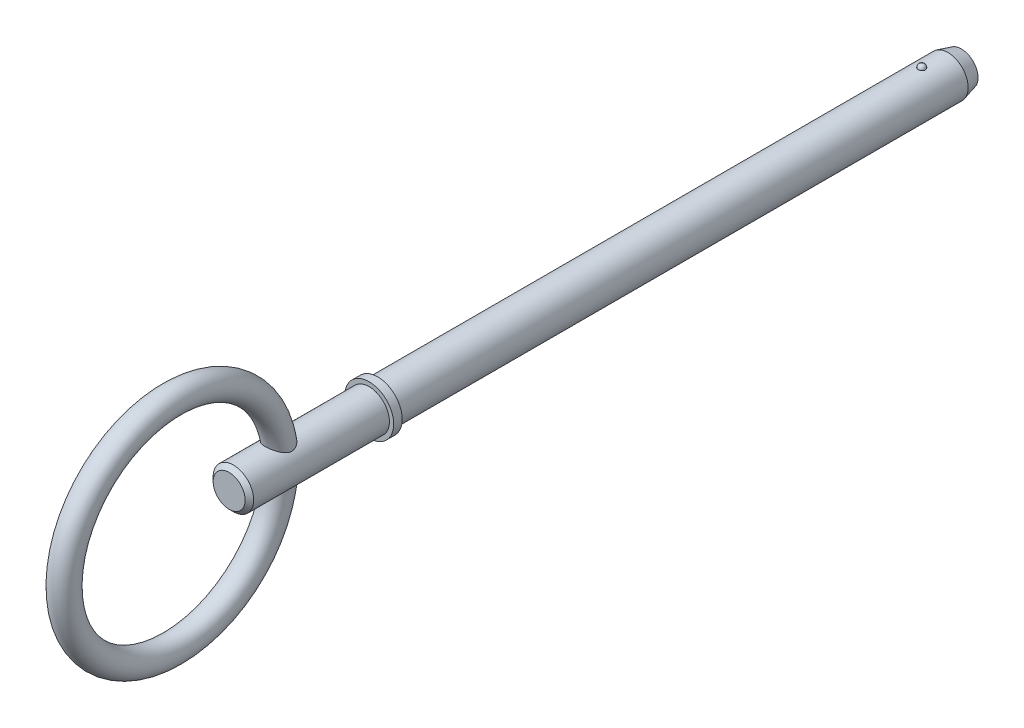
SolidWorks part; units mm, degrees
ref_plane "Front Plane" through (0, 0, 0) normal (0, 0, 1) x (1, 0, 0)
ref_plane "Top Plane" through (0, 0, 0) normal (0, 1, 0) x (1, 0, 0)
ref_plane "Right Plane" through (0, 0, 0) normal (1, 0, 0) x (0, 0, -1)
sketch "Sketch2" plane through (0, 0, 0) normal (0, 0, 1) x (1, 0, 0)
  circle A0 centre (0, 0) radius 2.38
  point P3 (0, 2.38)
  dimension "D1" = 4.76
extrude "Boss-Extrude1" add sketch "Sketch2" along normal blind 63.5
sketch "Sketch3" plane through (0, 0, 0) normal (0, 0, -1) x (-1, 0, 0)
  circle A0 centre (0, 0) radius 2.38
  dimension "D1" = 4.76
extrude "Boss-Extrude2" add sketch "Sketch3" along normal blind 5.08
chamfer "Chamfer1" distance 1.586 angle 15 1 edges at (-2.38, 0, -5.08)
sketch "Sketch18" plane through (0, 0, 0) normal (1, 0, 0) x (0, 0, -1)
  line L0 (3.494, 2.38) -> (-63.5, 2.38) construction
  line L1 (0.42, 2.8) -> (0.42, 1.96)
  line L2 (-63.5, -2.38) -> (3.494, -2.38) construction
  arc A0 (0.42, 2.8) -> (0.42, 1.96) centre (0.42, 2.38) ccw
  point P4 (0, 2.38)
  dimension "D1" = 5.18
revolve "Revolve1" add sketch "Sketch18" angle 360 about L1
sketch "Sketch19" plane through (0, 0, 0) normal (1, 0, 0) x (0, 0, -1)
  line L0 (-33.7288, 0) -> (-46.4542, 0) construction
sketch "Sketch20" plane through (0, 0, 0) normal (1, 0, 0) x (0, 0, -1)
  line L0 (-63.5, 0) -> (-63.5, 2.88)
  line L1 (-63.5, 2.38) -> (-63.5, -2.38) construction
  line L2 (-63.5, 2.88) -> (-64.5, 2.88)
  line L3 (-64.5, 2.88) -> (-64.5, 0)
  line L4 (-33.7288, 0) -> (-46.4542, 0) construction
  line L5 (-64.5, 0) -> (-63.5, 0)
  dimension "D1" = 2.88
  dimension "D2" = 1
revolve "Revolve2" add sketch "Sketch20" angle 360 about L0
sketch "Sketch21" plane through (0, 0, 63.5) normal (0, 0, -1) x (-1, 0, 0)
  circle A0 centre (0, 0) radius 2.38
  dimension "D1" = 4.76
extrude "Boss-Extrude3" add sketch "Sketch21" against normal blind 17.45
chamfer "Chamfer2" distance 0.5 angle 45 1 edges at (-2.38, 0, 80.95)
sketch "Sketch23" plane through (0, 0, 0) normal (1, 0, 0) x (0, 0, -1)
  line L0 (-80.95, 1.88) -> (-80.95, -1.88) construction
  circle A0 centre (-87.65, 0) radius 12.7
  point P2 (-74.95, 0)
  dimension "D1" = 25.4
  dimension "D2" = 6
sketch "Sketch24" plane through (0, 0, 0) normal (0, 1, 0) x (1, 0, 0)
  circle A0 centre (0, -74.95) radius 1.5
  dimension "D1" = 3
sweep "Sweep1" add profiles "Sketch24" path "Sketch23"
